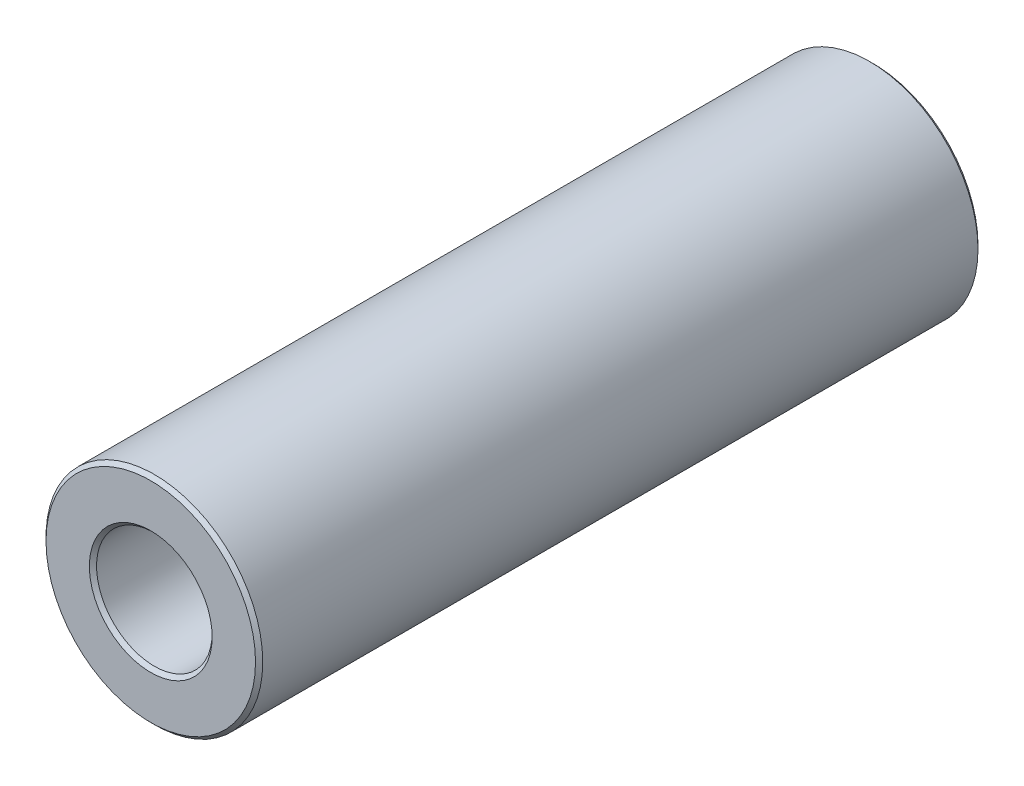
SolidWorks part; units mm, degrees
ref_plane "Front Plane" through (0, 0, 0) normal (0, 0, 1) x (1, 0, 0)
ref_plane "Top Plane" through (0, 0, 0) normal (0, 1, 0) x (1, 0, 0)
ref_plane "Right Plane" through (0, 0, 0) normal (1, 0, 0) x (0, 0, -1)
sketch "Sketch1" plane through (0, 0, 0) normal (0, 0, 1) x (1, 0, 0)
  circle A0 centre (0, 0) radius 3
  circle A1 centre (0, 0) radius 1.6
  dimension "D1" = 6
  dimension "D2" = 3.2
extrude "Boss-Extrude2" add sketch "Sketch1" along normal mid plane 20
chamfer "Chamfer3" distance 0.1 angle 45 4 edges at (3, 0, 10) (3, 0, -10) (1.6, 0, -10) (1.6, 0, 10)
